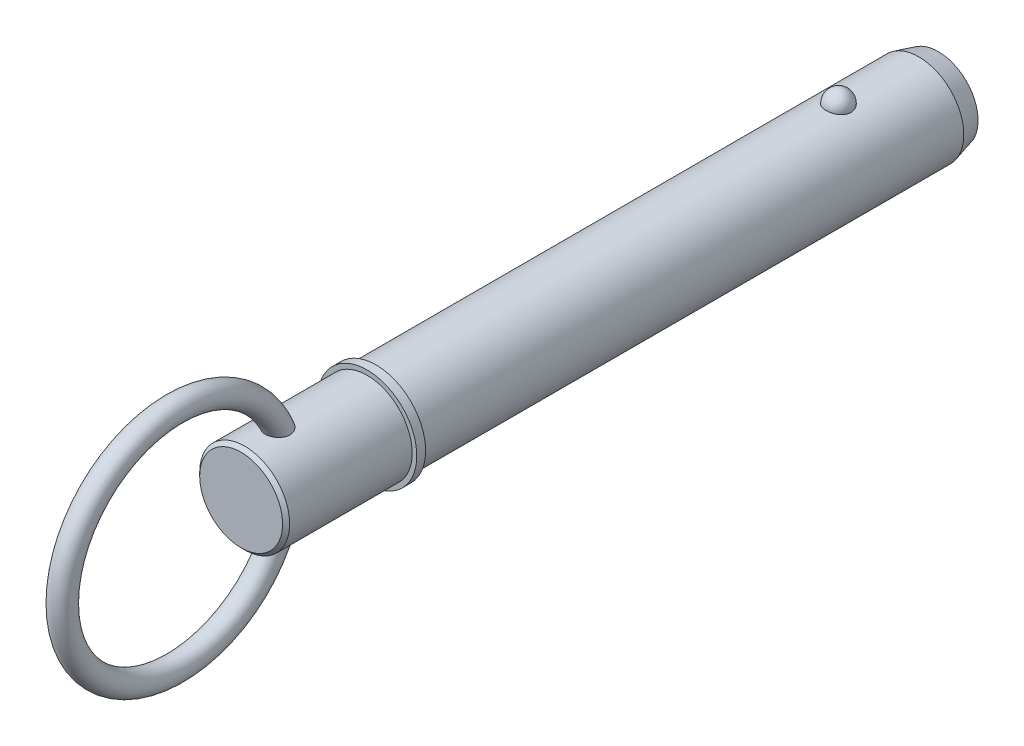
SolidWorks part; units mm, degrees
ref_plane "Front Plane" through (0, 0, 0) normal (0, 0, 1) x (1, 0, 0)
ref_plane "Top Plane" through (0, 0, 0) normal (0, 1, 0) x (1, 0, 0)
ref_plane "Right Plane" through (0, 0, 0) normal (1, 0, 0) x (0, 0, -1)
sketch "Sketch2" plane through (0, 0, 0) normal (0, 0, 1) x (1, 0, 0)
  circle A0 centre (0, 0) radius 12.7
  point P3 (0, 12.7)
  dimension "D1" = 25.4
extrude "Boss-Extrude1" add sketch "Sketch2" along normal blind 127
sketch "Sketch3" plane through (0, 0, 0) normal (0, 0, -1) x (-1, 0, 0)
  circle A0 centre (0, 0) radius 12.7
  dimension "D1" = 25.4
extrude "Boss-Extrude2" add sketch "Sketch3" along normal blind 31.75
chamfer "Chamfer1" distance 5.5 angle 15 1 edges at (-12.7, 0, -31.75)
sketch "Sketch18" plane through (0, 0, 0) normal (1, 0, 0) x (0, 0, -1)
  line L0 (26.25, 12.7) -> (-127, 12.7) construction
  line L1 (3.56, 16.26) -> (3.56, 9.14)
  line L2 (-127, -12.7) -> (26.25, -12.7) construction
  arc A0 (3.56, 16.26) -> (3.56, 9.14) centre (3.56, 12.7) ccw
  point P4 (0, 12.7)
  dimension "D1" = 28.96
revolve "Revolve1" add sketch "Sketch18" angle 360 about L1
sketch "Sketch19" plane through (0, 0, 0) normal (1, 0, 0) x (0, 0, -1)
  line L0 (-33.7288, 0) -> (-46.4542, 0) construction
sketch "Sketch20" plane through (0, 0, 0) normal (1, 0, 0) x (0, 0, -1)
  line L0 (-127, 0) -> (-127, 14)
  line L1 (-127, 12.7) -> (-127, -12.7) construction
  line L2 (-127, 14) -> (-129.5, 14)
  line L3 (-129.5, 14) -> (-129.5, 0)
  line L4 (-33.7288, 0) -> (-46.4542, 0) construction
  line L5 (-129.5, 0) -> (-127, 0)
  dimension "D1" = 14
  dimension "D2" = 2.5
revolve "Revolve2" add sketch "Sketch20" angle 360 about L0
sketch "Sketch21" plane through (0, 0, 127) normal (0, 0, -1) x (-1, 0, 0)
  circle A0 centre (0, 0) radius 12.7
  dimension "D1" = 25.4
extrude "Boss-Extrude3" add sketch "Sketch21" against normal blind 38.1
chamfer "Chamfer2" distance 1 angle 45 1 edges at (-12.7, 0, 165.1)
sketch "Sketch23" plane through (0, 0, 0) normal (1, 0, 0) x (0, 0, -1)
  line L0 (-165.1, 11.7) -> (-165.1, -11.7) construction
  circle A0 centre (-183.85, 0) radius 31.75
  point P2 (-152.1, 0)
  dimension "D1" = 63.5
  dimension "D2" = 13
sketch "Sketch24" plane through (0, 0, 0) normal (0, 1, 0) x (1, 0, 0)
  circle A0 centre (0, -152.1) radius 3.25
  dimension "D1" = 6.5
sweep "Sweep1" add profiles "Sketch24" path "Sketch23"
